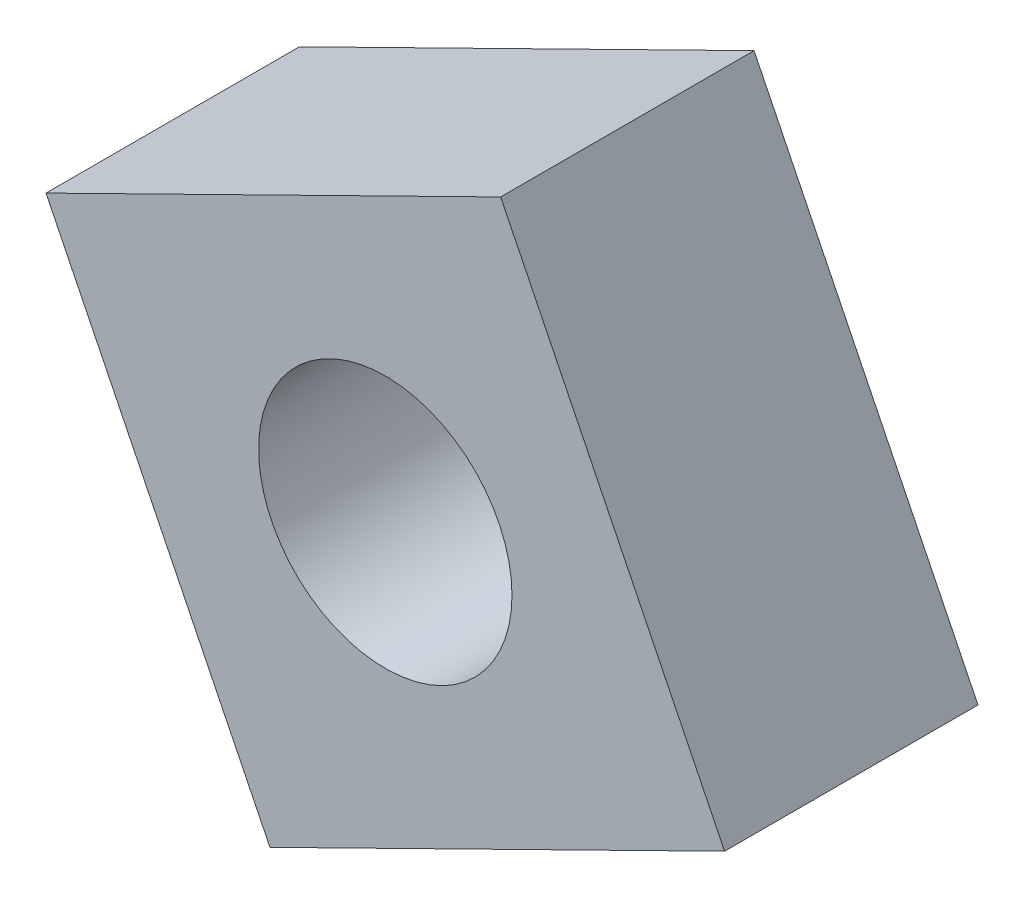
SolidWorks part; units mm, degrees
ref_plane "Plan de face" through (0, 0, 0) normal (0, 0, 1) x (1, 0, 0)
ref_plane "Plan de dessus" through (0, 0, 0) normal (0, 1, 0) x (1, 0, 0)
ref_plane "Plan de droite" through (0, 0, 0) normal (1, 0, 0) x (0, 0, -1)
sketch "Esquisse1" plane through (0, 0, 0) normal (0, 0, 1) x (1, 0, 0)
  line L0 (-2.6779, 0.9104) -> (-0.9104, -2.6779)
  line L1 (-0.9104, -2.6779) -> (2.6779, -0.9104)
  line L2 (2.6779, -0.9104) -> (0.9104, 2.6779)
  line L3 (-2.6779, 0.9104) -> (0.9104, 2.6779)
  circle A1 centre (0, 0) radius 1
  dimension "D1" = 4
  dimension "D2" = 2
  dimension "D3" = 4
  dimension "D4" = 2
extrude "Boss.-Extru.1" add sketch "Esquisse1" along normal blind 2
